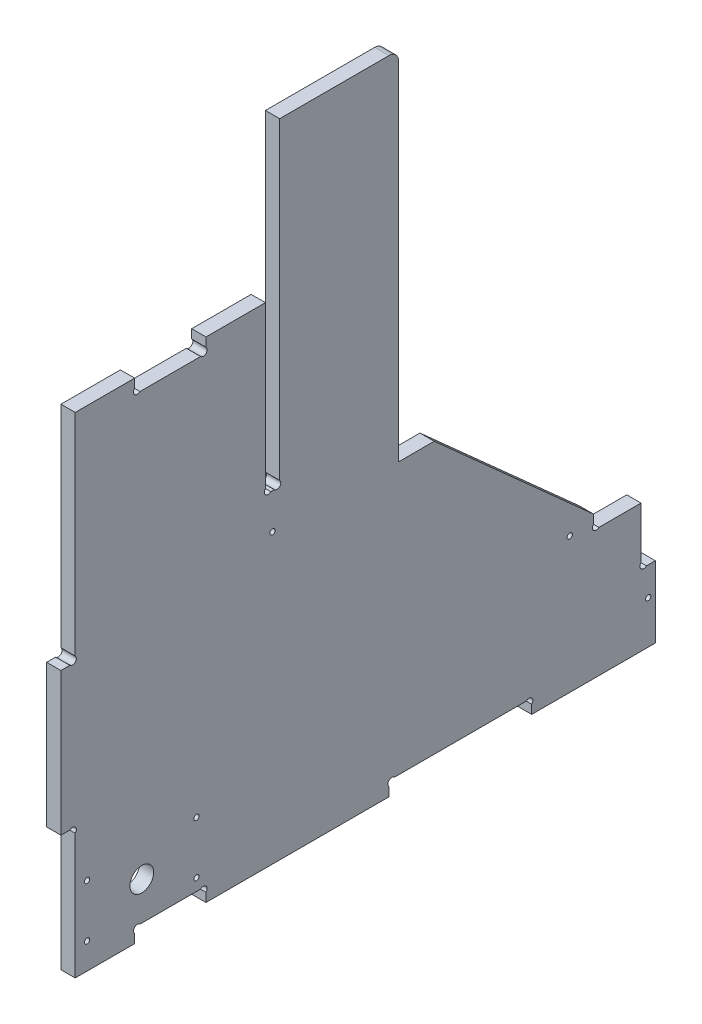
SolidWorks part; units mm, degrees
ref_plane "Plan de face" through (0, 0, 0) normal (0, 0, 1) x (1, 0, 0)
ref_plane "Plan de dessus" through (0, 0, 0) normal (0, 1, 0) x (1, 0, 0)
ref_plane "Plan de droite" through (0, 0, 0) normal (1, 0, 0) x (0, 0, -1)
sketch "Esquisse1" plane through (0, 0, 0) normal (1, 0, 0) x (0, 0, -1)
  line L0 (0, -10.3129) -> (0, 307.1625) construction
  line L1 (-27.1936, 0) -> (367.4162, 0) construction
  line L2 (250, -20.9884) -> (250, 307.1625) construction
  line L3 (-42.7575, 206) -> (335.9747, 206) construction
  line L4 (6, -10.2465) -> (6, 221.4835) construction
  line L5 (86, 221.4835) -> (86, -10.2465) construction
  line L6 (92, 293.2296) -> (92, -10.2465) construction
  line L7 (-27.1936, 85) -> (99.5, 85) construction
  line L8 (46, 217.6688) -> (46, 164.32) construction
  line L9 (-14.9402, 55) -> (12.8096, 55) construction
  line L10 (6, 55) -> (-12.1466, 36.8534) construction
  line L11 (307.6827, 120) -> (131.765, 120) construction
  line L12 (293.0929, 54) -> (212.3616, 54) construction
  line L13 (-27.1936, 270) -> (367.4162, 270) construction
  line L14 (142, 293.2296) -> (142, 110.073) construction
  line L15 (157, 110.073) -> (157, 160.2369) construction
  line L16 (224, 71.6739) -> (224, 52.7373) construction
  line L17 (3.7373, 115) -> (0, 115)
  line L18 (0, 115) -> (0, 55)
  line L19 (0, 55) -> (3.7373, 55)
  line L20 (168, -20.922) -> (168, 30.0664) construction
  line L21 (281.6491, 6) -> (-7.9402, 6) construction
  line L22 (-27.1936, 200) -> (96.2119, 200) construction
  line L23 (-42.7575, 103) -> (12.8096, 103) construction
  line L24 (61, 196.9699) -> (61, 217.6688) construction
  line L25 (61, 200) -> (49.322, 211.678) construction
  line L28 (31, 202.2627) -> (31, 206)
  line L29 (33.2627, 200) -> (58.7373, 200)
  line L30 (61, 202.2627) -> (61, 206)
  line L31 (61, 3.7373) -> (61, 0)
  line L32 (33.2627, 6) -> (58.7373, 6)
  line L33 (31, 3.7373) -> (31, 0)
  line L34 (6, 52.7373) -> (6, 0)
  line L35 (6, 0) -> (31, 0)
  line L36 (6, 117.2627) -> (6, 206)
  line L37 (6, 206) -> (31, 206)
  line L38 (61, 206) -> (86, 206)
  line L39 (92, 138.2627) -> (92, 270)
  line L40 (92, 270) -> (138, 270)
  line L41 (142, 266) -> (142, 120)
  line L42 (142, 120) -> (157, 120)
  line L43 (244, -20.9884) -> (244, 105.1987) construction
  line L44 (198, 15.2678) -> (198, -20.922) construction
  line L45 (198, 6) -> (181.9345, -10.0655) construction
  line L46 (246.1034, 30) -> (281.6491, 30) construction
  line L47 (244, 30) -> (260.3532, 46.3532) construction
  line L50 (246.1034, 18) -> (268.7739, 18) construction
  line L51 (247, 27.5504) -> (247, 15.2014) construction
  line L52 (276.9425, 57) -> (213.1987, 57) construction
  line L53 (204, 66) -> (204, 34.0619) construction
  line L54 (214, 66) -> (214, 48.1216) construction
  line L55 (250, 0) -> (198, 0)
  line L56 (198, 3.7373) -> (198, 0)
  line L57 (140.2627, 6) -> (195.7373, 6)
  line L58 (138, 3.7373) -> (138, 0)
  line L59 (61, 0) -> (138, 0)
  line L61 (89, 126.9162) -> (89, 78.6724) construction
  line L62 (68.0786, 121) -> (99.5, 121) construction
  line L63 (99.5, 156) -> (116.478, 156) construction
  line L64 (116.478, 136) -> (73.5, 136) construction
  line L65 (86, 136) -> (99.17, 149.17) construction
  line L66 (88.2627, 136) -> (89.7373, 136)
  line L67 (11, 28.858) -> (11, 17.25) construction
  line L68 (217.4532, 106) -> (55.808, 106) construction
  line L69 (86, 206) -> (86, 138.2627)
  line L70 (7, 7) -> (61, 7) construction
  line L71 (86, 200) -> (100.2675, 214.2675) construction
  line L72 (7, 7) -> (7, 37) construction
  line L73 (7, 37) -> (61, 37) construction
  line L74 (61, 7) -> (61, 37) construction
  line L75 (7, 7) -> (61, 37) construction
  line L76 (7, 37) -> (61, 7) construction
  line L77 (10.2966, 11) -> (30.0854, 11) construction
  line L78 (34, 22) -> (34, 57.6059) construction
  line L79 (57.3418, 22) -> (29.1147, 22) construction
  line L80 (244, 54) -> (244, 32.2627)
  line L81 (246.2627, 30) -> (250, 30)
  line L82 (250, 30) -> (250, 0)
  line L83 (293.0929, 60) -> (202.7373, 60) construction
  line L84 (224, 60) -> (157, 120)
  line L85 (224, 54) -> (238.9187, 68.9187) construction
  line L86 (224, 60) -> (224, 56.2627)
  line L87 (226.2627, 54) -> (244, 54)
  arc A0 (6, 52.7373) -> (3.7373, 55) centre (4.8686, 53.8686) ccw
  arc A1 (6, 117.2627) -> (3.7373, 115) centre (4.8686, 116.1314) cw
  arc A2 (58.7373, 200) -> (61, 202.2627) centre (59.8686, 201.1314) ccw
  arc A3 (224, 56.2627) -> (226.2627, 54) centre (225.1314, 55.1314) ccw
  arc A4 (33.2627, 200) -> (31, 202.2627) centre (32.1314, 201.1314) cw
  arc A7 (33.2627, 6) -> (31, 3.7373) centre (32.1314, 4.8686) ccw
  circle A8 centre (11, 11) radius 1.1
  arc A9 (58.7373, 6) -> (61, 3.7373) centre (59.8686, 4.8686) cw
  circle A10 centre (57, 33) radius 1.1
  arc A11 (244, 32.2627) -> (246.2627, 30) centre (245.1314, 31.1314) ccw
  circle A12 centre (57, 11) radius 1.1
  arc A13 (198, 3.7373) -> (195.7373, 6) centre (196.8686, 4.8686) ccw
  arc A14 (138, 270) -> (142, 266) centre (138, 266) cw
  arc A15 (138, 3.7373) -> (140.2627, 6) centre (139.1314, 4.8686) cw
  circle A16 centre (11, 33) radius 1.1
  arc A17 (86, 138.2627) -> (88.2627, 136) centre (87.1314, 137.1314) ccw
  arc A18 (92, 138.2627) -> (89.7373, 136) centre (90.8686, 137.1314) cw
  circle A19 centre (34, 22) radius 5
  circle A20 centre (247, 18) radius 1.1
  circle A21 centre (89, 121) radius 1.1
  circle A24 centre (214, 57) radius 1.1
  point P86 (34, 22)
  point P128 (142, 270)
  dimension "D15" = 6
  dimension "D23" = 6
  dimension "D32" = 4
  dimension "D36" = 100
  dimension "D39" = 45
  dimension "D40" = 1
  dimension "D43" = 40
  dimension "D46" = 6
  dimension "D1" = 206
  dimension "D2" = 250
  dimension "D3" = 6
  dimension "D4" = 6
  dimension "D5" = 80
  dimension "D6" = 85
  dimension "D7" = 30
  dimension "D8" = 45
  dimension "D9" = 40
  dimension "D10" = 120
  dimension "D11" = 24
  dimension "D12" = 270
  dimension "D13" = 50
  dimension "D14" = 15
  dimension "D16" = 76
  dimension "D17" = 6
  dimension "D18" = 103
  dimension "D19" = 15
  dimension "D20" = 45
  dimension "D24" = 12
  dimension "D25" = 24
  dimension "D26" = 45
  dimension "D27" = 30
  dimension "D30" = 45
  dimension "D31" = 3
  dimension "D33" = 1
  dimension "D34" = 50
  dimension "D35" = 15
  dimension "D37" = 20
  dimension "D38" = 45
  dimension "D41" = 4
  dimension "D42" = 4
  dimension "D44" = 10
  dimension "D45" = 3
  dimension "D47" = 20
  dimension "D48" = 45
extrude "Boss.-Extru.1" add sketch "Esquisse1" along normal blind 6
